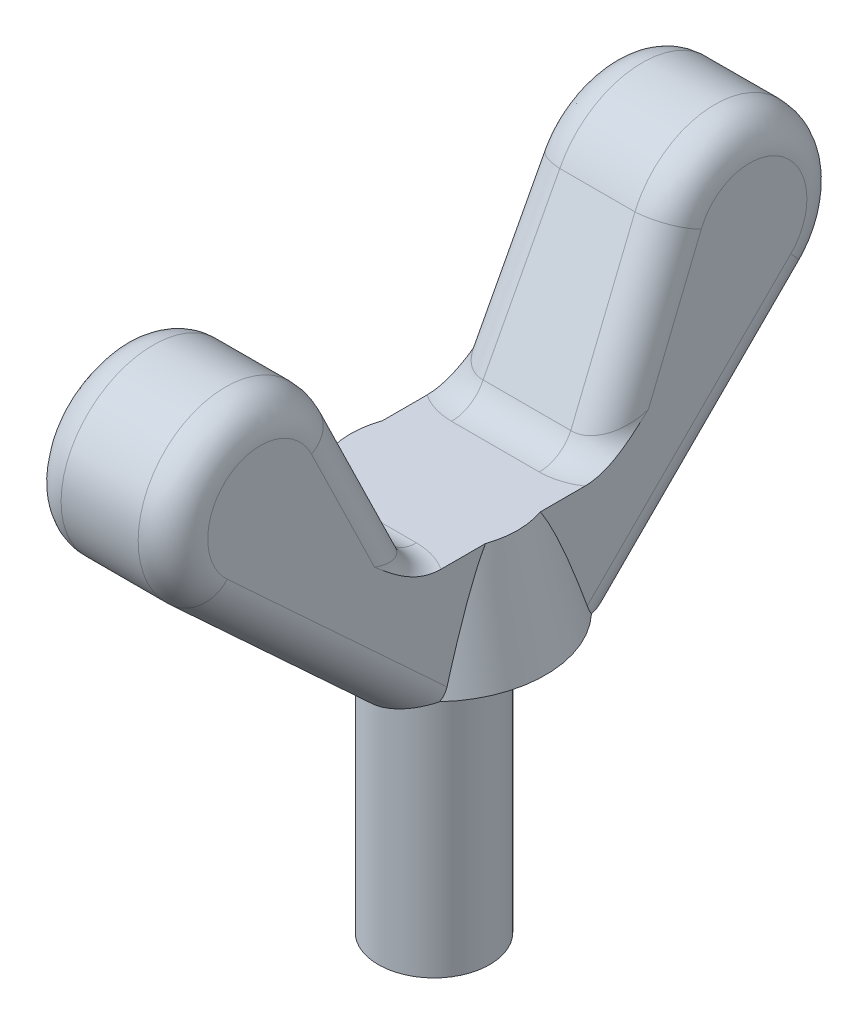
SolidWorks part; units mm, degrees
ref_plane "Front Plane" through (0, 0, 0) normal (0, 0, 1) x (1, 0, 0)
ref_plane "Top Plane" through (0, 0, 0) normal (0, 1, 0) x (1, 0, 0)
ref_plane "Right Plane" through (0, 0, 0) normal (1, 0, 0) x (0, 0, -1)
sketch "Sketch1" plane through (0, 0, 0) normal (0, 0, 1) x (1, 0, 0)
  line L0 (0, 60.5151) -> (0, -41.7102) construction
  line L1 (0, 0) -> (-1, 0)
  line L2 (-1, 0) -> (-1, 5)
  line L3 (-1, 5) -> (-2, 5)
  line L4 (-2, 5) -> (-1.5, 7)
  line L5 (-1.5, 7) -> (0, 7)
  line L6 (0, 0) -> (0, 7)
  dimension "D1" = 5
  dimension "D2" = 2
  dimension "D3" = 2
  dimension "D4" = 4
  dimension "D5" = 3
revolve "Revolve1" add sketch "Sketch1" angle 360 about L0
sketch "Sketch2" plane through (0, 0, 0) normal (0, 0, 1) x (1, 0, 0)
  line L0 (0, 5) -> (0, 11) construction
  line L1 (-1, 5) -> (1, 5) construction
  line L2 (1.5, 5) -> (-1.5, 5)
  line L3 (-1.5, 5) -> (-1.25, 11)
  line L4 (-1.25, 11) -> (1.25, 11)
  line L5 (-2, 5) -> (2, 5) construction
  line L6 (1.5, 5) -> (1.25, 11)
  dimension "D1" = 2.5
  dimension "D2" = 3
  dimension "D3" = 6
extrude "Extrude1" add sketch "Sketch2" along normal mid plane 12 separate body
sketch "Sketch5" plane through (0, 0, 0) normal (1, 0, 0) x (0, 0, -1)
  line L0 (-2, 5) -> (-5.481, 8.2068)
  line L1 (-6, 5) -> (-6, 11) construction
  line L4 (-2.9319, 10.0707) -> (-1.5, 7)
  line L5 (-1.5, 7) -> (-2, 5) construction
  line L6 (0, 0) -> (0, 20.6602) construction
  line L7 (-1.5, 7) -> (1.5, 7)
  line L8 (1.5, 7) -> (-1.5, 7) construction
  line L9 (-2, 5) -> (-7, 5)
  line L10 (-7, 5) -> (-7, 12)
  line L11 (-7, 12) -> (7, 12)
  line L12 (7, 5) -> (7, 12)
  line L13 (2, 5) -> (7, 5)
  line L14 (2, 5) -> (5.481, 8.2068)
  line L16 (2.9319, 10.0707) -> (1.5, 7)
  line L18 (-6, 11) -> (6, 11) construction
  arc A1 (-5.481, 8.2068) -> (-2.9319, 10.0707) centre (-4.3906, 9.3906) cw
  arc A2 (5.481, 8.2068) -> (2.9319, 10.0707) centre (4.3906, 9.3906) ccw
  point P23 (0, 12)
  point P26 (0, 7)
  dimension "D1" = 115
  dimension "D2" = 14
  dimension "D4" = 7
extrude "Cut-Extrude1" cut sketch "Sketch5" against normal through all and the other way through all
combine bodies "Combine1" operation type add bodies to combine 103 101
fillet "Fillet2" radius 0.625 12 edges at (1.4332, 6.6034, -3.7405) (1.2629, 10.6897, -5.3405) (-1.4332, 6.6034, -3.7405) (-1.2629, 10.6897, -5.3405) (-1.4332, 6.6034, 3.7405) (-1.2629, 10.6897, 5.3405) (1.4332, 6.6034, 3.7405) (1.2629, 10.6897, 5.3405) (1.3527, 8.5354, -2.216) (-1.3527, 8.5354, -2.216) (-1.3527, 8.5354, 2.216) (1.3527, 8.5354, 2.216)
fillet "Fillet3" radius 0.625 6 edges at (-1.2373, 7, -1.6977) (1.2373, 7, -1.6977) (-1.2373, 7, 1.6977) (1.2373, 7, 1.6977) (0, 7, -1.5) (0, 7, 1.5)
chamfer "Chamfer1" [suppressed] distance 0.4 angle 45
sketch "Sketch6" plane through (0, 0, 0) normal (1, 0, 0) x (0, 0, -1)
  line L0 (0, 7) -> (0, 0) construction
  line L1 (0.493, 7) -> (-0.493, 7) construction
  line L4 (0, 0) -> (0, -0.1)
  line L5 (0, -0.1) -> (1.1, -0.1)
  line L6 (1.1, -0.1) -> (1.1, 0.4)
  line L7 (1.1, 0.4) -> (1, 0.4)
  line L8 (-1, 0) -> (1, 0) construction
  arc A0 (0, 0) -> (1, 0.4) centre (0, 1.45) ccw
  dimension "D1" = 0.4
  dimension "D2" = 0.1
  dimension "D3" = 0.1
  dimension "D4" = 2
revolve "Cut-Revolve1" [suppressed] cut sketch "Sketch6" angle 360 about L0
sketch "Sketch7" plane through (0, 0, 0) normal (1, 0, 0) x (0, 0, -1)
  line L0 (1, 5) -> (0.6536, 4.8)
  line L1 (0.6536, 4.8) -> (1, 4.6)
  line L2 (1, 4.6) -> (1.1, 4.6)
  line L3 (1.1, 4.6) -> (1.1, 5)
  line L4 (1.1, 5) -> (1, 5)
  line L5 (0.6536, 4.8) -> (1.1, 4.8) construction
  line L6 (-1.3638, 5) -> (1.3638, 5) construction
  line L8 (0, 0) -> (0, 8.3389) construction
  dimension "D1" = 0.1
  dimension "D2" = 60
  dimension "D3" = 0.4
  dimension "D4" = 2
revolve "Cut-Revolve10" [suppressed] cut sketch "Sketch7" angle 360 about L8
pattern_linear "LPattern10" [suppressed] count 10 spacing 0.48 along (0, -1, 0)
equation "\"D4@Sketch5\" = \"D3@Sketch2\" + 1"
equation "\"D2@Sketch5\" =\"D1@Extrude1\" + 2"
equation "\"D1@ThreadCosmetic1\" = \"D1@Sketch1\""
equation "\"D2@ThreadCosmetic1\" = \"D3@Sketch1\" - 2 * \"D1@Chamfer1\""
equation "\"D1@Fillet2\" = \"D1@Sketch2\" / 4"
equation "\"D1@Fillet3\" = \"D1@Sketch2\" / 4"
equation "\"D1@Sketch6\" = \"D1@Chamfer1\""
equation "\"D4@Sketch6\" = \"D3@Sketch1\""
equation "\"D3@Sketch7\" = \"D1@Chamfer1\""
equation "\"D3@LPattern10\" = \"D3@Sketch7\" * 1.2"
equation "\"D1@LPattern10\" = \"D1@ThreadCosmetic1\" / \"D3@LPattern10\""
equation "\"D4@Sketch7\" = \"D3@Sketch1\""
